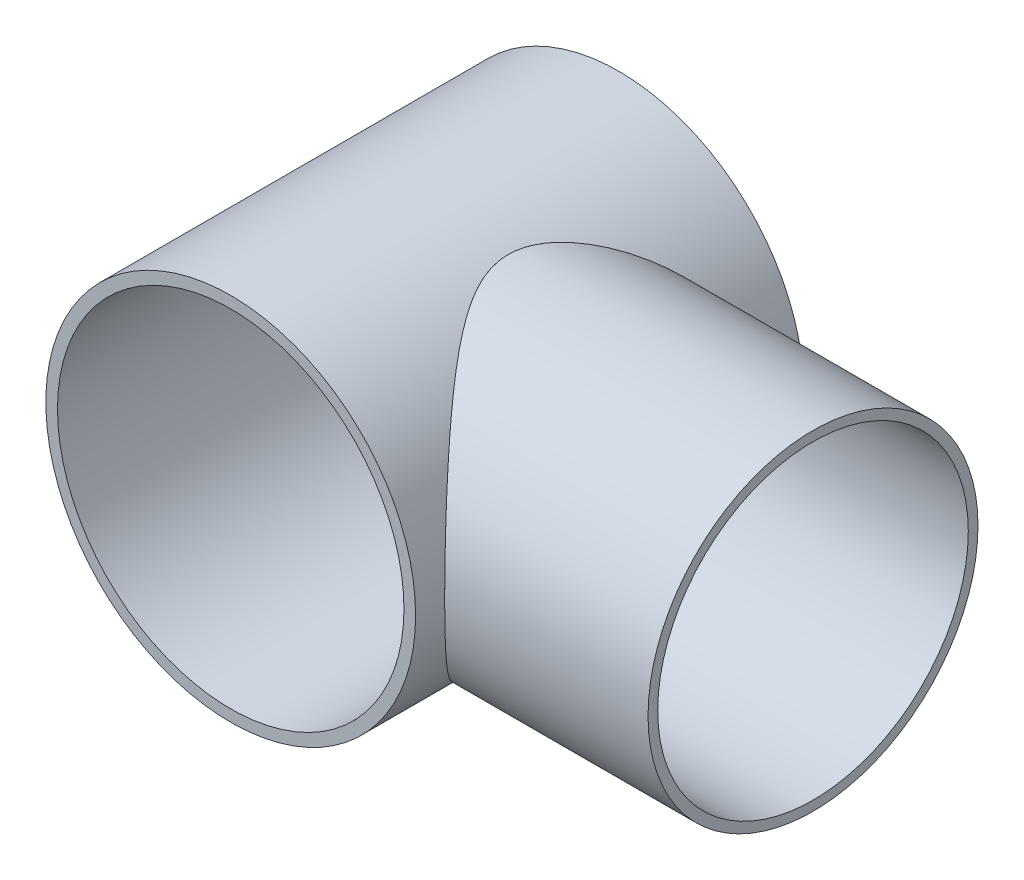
SolidWorks part; units mm, degrees
ref_plane "Ebene vorne" through (0, 0, 0) normal (0, 0, 1) x (1, 0, 0)
ref_plane "Ebene oben" through (0, 0, 0) normal (0, 1, 0) x (1, 0, 0)
ref_plane "Ebene rechts" through (0, 0, 0) normal (1, 0, 0) x (0, 0, -1)
sketch "Skizze1" plane through (0, 0, 0) normal (0, 0, 1) x (1, 0, 0)
  circle A0 centre (0, 0) radius 57.15
  circle A1 centre (0, 0) radius 53.55
  dimension "D1" = 114.3
  dimension "D2" = 3.6
extrude "Ø114,3x3,6" add sketch "Skizze1" along normal mid plane 120
sketch "Skizze2" plane through (0, 0, 0) normal (1, 0, 0) x (0, 0, -1)
  circle A0 centre (0, 0) radius 51
  circle A1 centre (0, 0) radius 48
  dimension "D1" = 102
  dimension "D2" = 3
extrude "Ø120x3" add sketch "Skizze2" along normal blind 120 separate body
split "Abspalten1" bodies to split 101 102 resulting bodies 103 104 105
delete or keep bodies "Körper-Löschen/beibehalten 1" type delete bodies bodies 105
